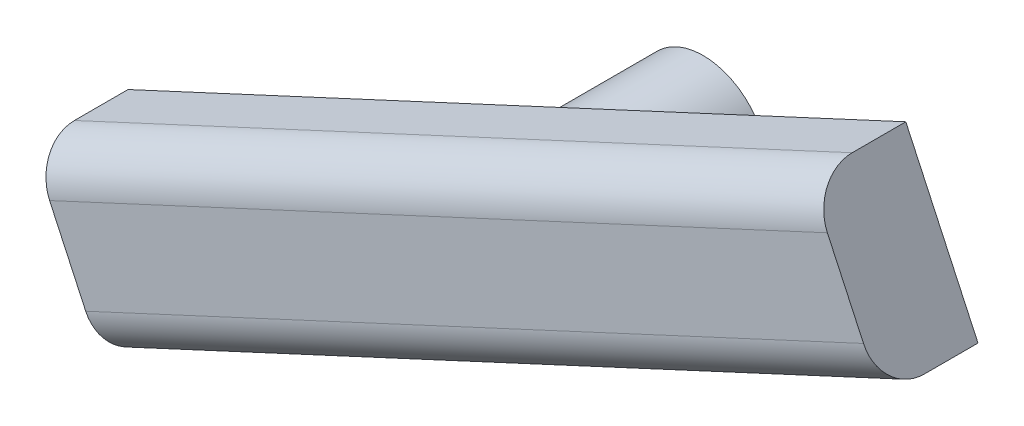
SolidWorks part; units mm, degrees
ref_plane "Alzado" through (0, 0, 0) normal (0, 0, 1) x (1, 0, 0)
ref_plane "Planta" through (0, 0, 0) normal (0, 1, 0) x (1, 0, 0)
ref_plane "Vista lateral" through (0, 0, 0) normal (1, 0, 0) x (0, 0, -1)
sketch3d "Sk_Vastago"
  line L0 (455.3416, 345.3626, -22) -> (455.3416, 345.3626, -15)
sweep "Vastago" add path "Sk_Vastago" parameters "D3"=6
sketch "Sk_Goma" plane through (0, 0, 0) normal (0, 0, 1) x (1, 0, 0)
  line L0 (438.8839, 333.315) -> (435.5162, 340.5716)
  line L1 (435.5162, 340.5716) -> (471.7992, 357.4103)
  line L2 (471.7992, 357.4103) -> (475.1669, 350.1537)
  line L3 (475.1669, 350.1537) -> (438.8839, 333.315)
extrude "Goma" add sketch "Sk_Goma" along normal blind 4.5 from offset 15
fillet "Redondeo1" radius 2 2 edges at (457.0254, 341.7343, -10.5) (453.6577, 348.9909, -10.5)
